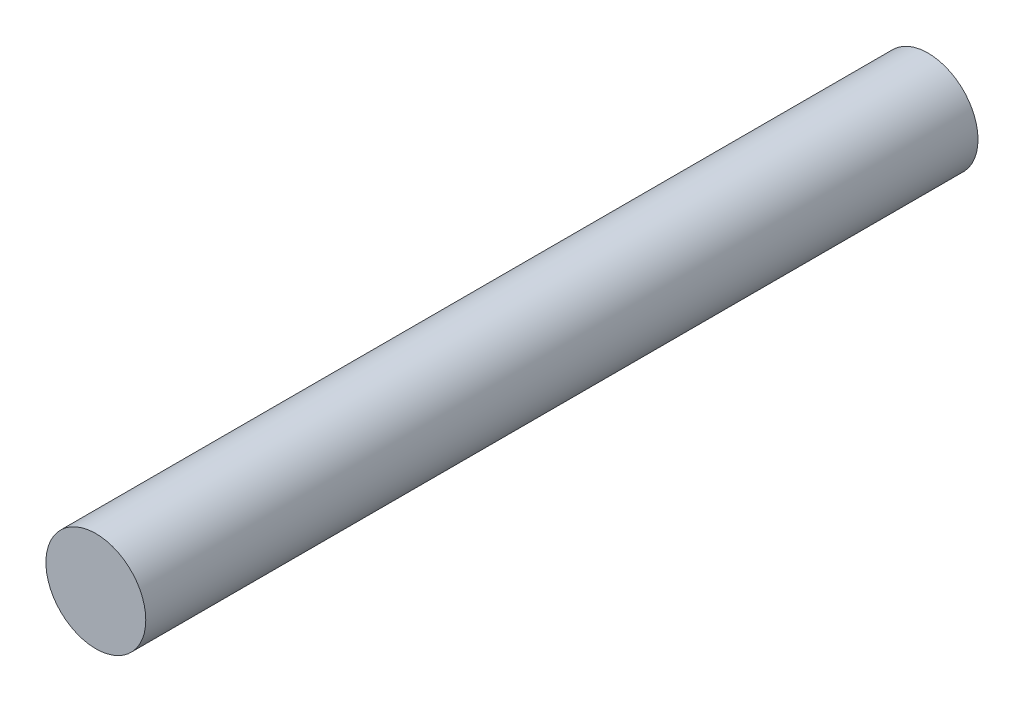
SolidWorks part; units mm, degrees
ref_plane "Front Plane" through (0, 0, 0) normal (0, 0, 1) x (1, 0, 0)
ref_plane "Top Plane" through (0, 0, 0) normal (0, 1, 0) x (1, 0, 0)
ref_plane "Right Plane" through (0, 0, 0) normal (1, 0, 0) x (0, 0, -1)
sketch "Sketch1" plane through (0, 0, 0) normal (0, 0, 1) x (1, 0, 0)
  circle A0 centre (0, 0) radius 30
  dimension "D1" = 60
extrude "Boss-Extrude1" add sketch "Sketch1" against normal blind 500
